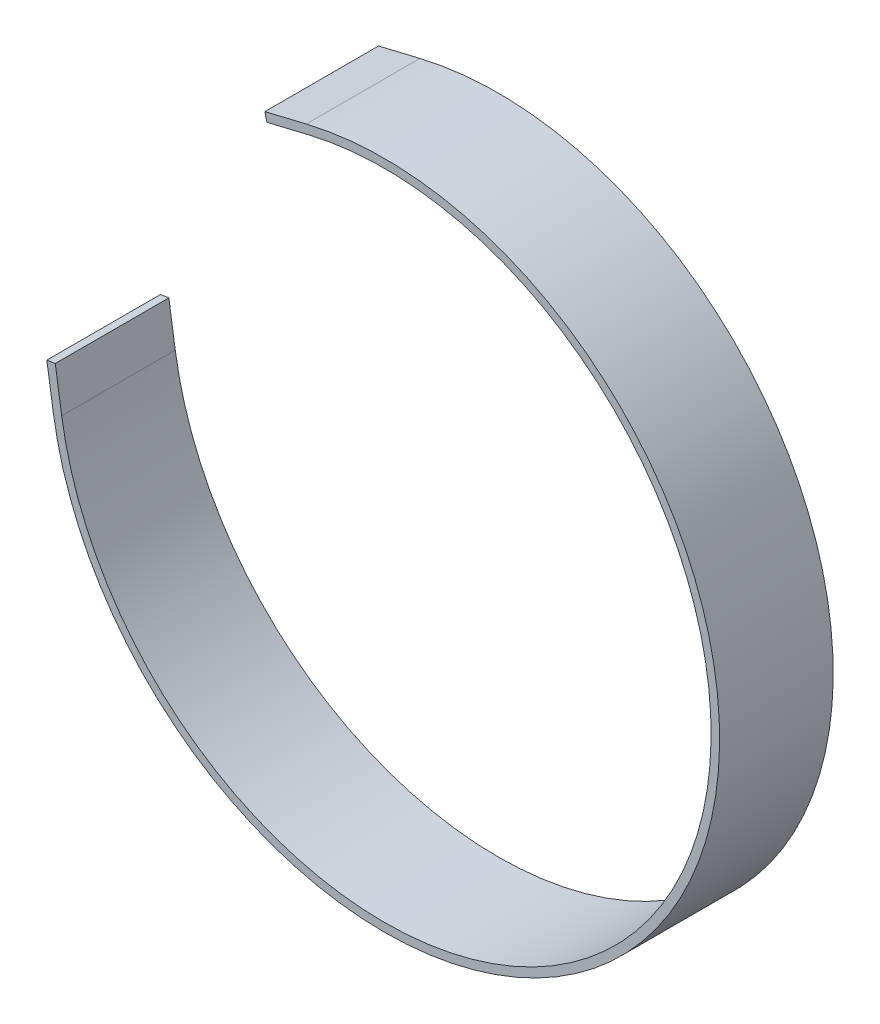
SolidWorks part; units mm, degrees
ref_plane "Plan de face" through (0, 0, 0) normal (0, 0, 1) x (1, 0, 0)
ref_plane "Plan de dessus" through (0, 0, 0) normal (0, 1, 0) x (1, 0, 0)
ref_plane "Plan de droite" through (0, 0, 0) normal (1, 0, 0) x (0, 0, -1)
sketch "Esquisse1" plane through (0, 0, 0) normal (0, 0, 1) x (1, 0, 0)
  line L0 (0, 0) -> (-70.2863, 292.7635) construction
  line L1 (0, 0) -> (-355.905, -54.2069) construction
  line L2 (0, 0) -> (0, 181.2087) construction
  line L3 (-233.3094, -35.5347) -> (-237.8265, -5.8767)
  line L4 (-227.3778, -34.6313) -> (-231.8949, -4.9733)
  line L5 (-231.8949, -4.9733) -> (-237.8265, -5.8767)
  line L6 (-55.0931, 229.4793) -> (-84.2642, 222.4759)
  line L7 (-53.6924, 223.6451) -> (-82.8635, 216.6417)
  line L8 (-82.8635, 216.6417) -> (-84.2642, 222.4759)
  arc A0 (-233.3094, -35.5347) -> (-55.0931, 229.4793) centre (0, 0) ccw
  arc A1 (-227.3778, -34.6313) -> (-53.6924, 223.6451) centre (0, 0) ccw
  dimension "D3" = 236
  dimension "D4" = 230
  dimension "D1" = 13.5
  dimension "D2" = 98.66
  dimension "D5" = 30
  dimension "D6" = 30
extrude "Extrusion1" add sketch "Esquisse1" along normal blind 80
